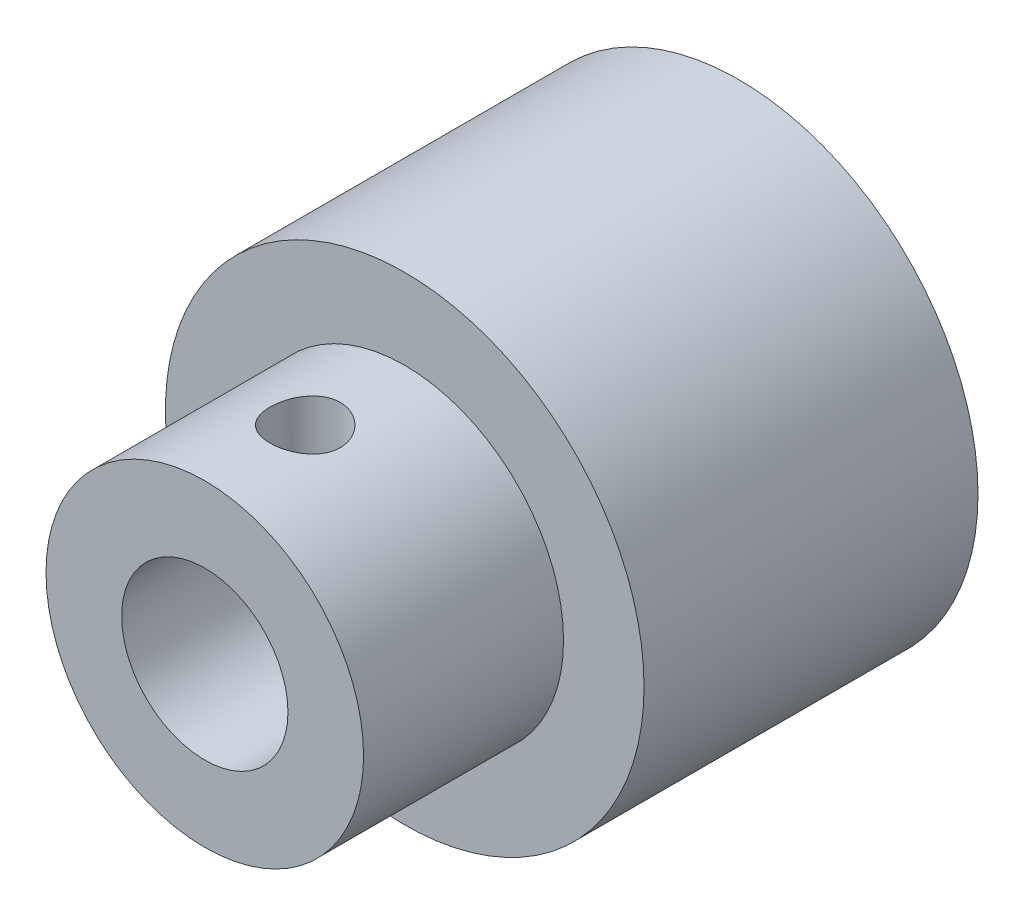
SolidWorks part; units mm, degrees
ref_plane "Front" through (0, 0, 0) normal (0, 0, 1) x (1, 0, 0)
ref_plane "Top" through (0, 0, 0) normal (0, 1, 0) x (1, 0, 0)
ref_plane "Right" through (0, 0, 0) normal (1, 0, 0) x (0, 0, -1)
sketch "Sketch1" plane through (0, 0, 0) normal (0, 0, 1) x (1, 0, 0)
  circle A0 centre (0, 0) radius 14.2875
  dimension "D1" = 28.575
extrude "Extrude1" add sketch "Sketch1" against normal blind 19.939
sketch "Sketch2" plane through (0, 0, 0) normal (0, 0, 1) x (1, 0, 0)
  circle A0 centre (0, 0) radius 9.4806
  dimension "D1" = 18.9611
extrude "Extrude2" add sketch "Sketch2" along normal blind 11.938
hole_wizard "Ø10.0 (10) Diameter Hole1" positions "Sketch4" profile "Sketch3" hole size "Ø10.0" standard "Ansi Metric"
sketch "Sketch4" plane through (0, 0, 11.938) normal (0, 0, 1) x (1, 0, 0)
  point P0 (0, 0)
sketch "Sketch3" plane through (0, 0, 11.938) normal (1, 0, 0) x (0, -1, 0)
  line L0 (0, 0) -> (0, 31.877)
  line L1 (0, 31.877) -> (4.9657, 31.877)
  line L2 (4.9657, 31.877) -> (4.9657, 0)
  line L5 (4.9657, 0) -> (0, 0)
  line L11 (0, -6.35) -> (0, 107.95) construction
  dimension "Thru Hole Dia." = 9.9314
  dimension "Thru Hole Depth" = 31.877
sketch3d "CenterOfMass 10/16/2008 14:54:08"
  point P0 (0, 0, -8.2728)
hole_wizard "M5x0.8 Tapped Hole1" positions "3DSketch1" profile "Sketch5" tap size "M5x0.8" standard "Ansi Metric"
sketch3d "3DSketch1"
  point P0 (0, 9.4806, 5.9436)
sketch "Sketch5" plane through (0, 9.4806, 5.9436) normal (1, 0, 0) x (0, 0, 1)
  line L0 (0, 0) -> (0, 4.5149)
  line L1 (0, 4.5149) -> (2.1, 4.5149)
  line L2 (2.1, 4.5149) -> (2.1, 0)
  line L5 (2.1, 0) -> (0, 0)
  line L11 (0, -6.35) -> (0, 107.95) construction
  dimension "Thru Tap Drill Dia." = 4.2
  dimension "Thru Tap Drill Depth" = 4.5149
